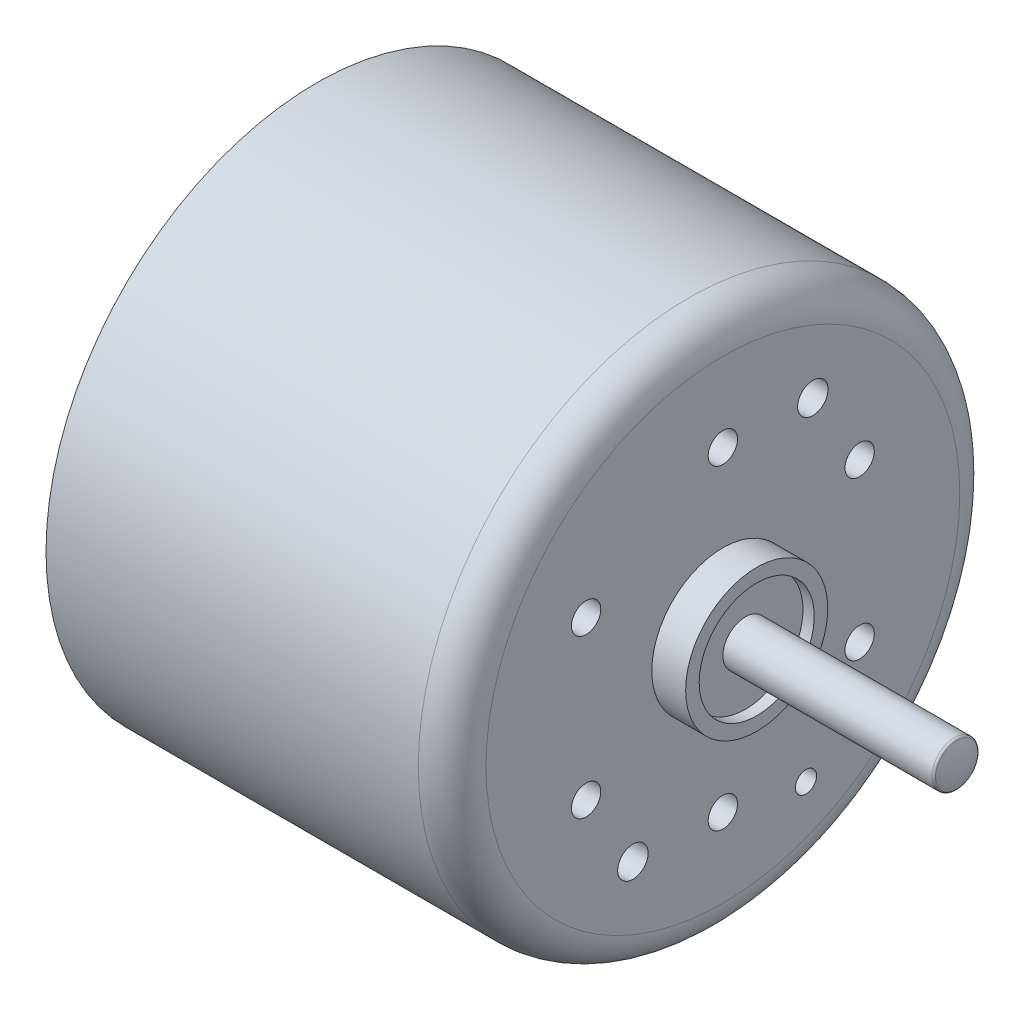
SolidWorks part; units mm, degrees
ref_plane "Plan de face" through (0, 0, 0) normal (0, 0, 1) x (1, 0, 0)
ref_plane "Plan de dessus" through (0, 0, 0) normal (0, 1, 0) x (1, 0, 0)
ref_plane "Plan de droite" through (0, 0, 0) normal (1, 0, 0) x (0, 0, -1)
sketch "Esquisse1" plane through (0, 0, 0) normal (0, 0, 1) x (1, 0, 0)
  line L0 (0, 0) -> (72.656, 0) construction
  line L1 (0, 0) -> (0, 0.8734)
  line L2 (1.0359, 3.2) -> (2.5, 3.2)
  line L3 (2.5, 3.2) -> (2.5, 11.4)
  line L4 (2.5, 11.4) -> (2, 11.4)
  line L5 (2, 11.4) -> (2, 12)
  line L6 (2, 12) -> (18.5, 12)
  line L7 (20, 10.5) -> (20, 3.15)
  line L8 (20, 3.15) -> (21.5, 3.15)
  line L9 (21.5, 3.15) -> (21.5, 2.55)
  line L10 (21.5, 2.55) -> (21, 2.55)
  line L11 (21, 2.55) -> (21, 1)
  line L12 (21, 1) -> (30.2684, 1)
  line L14 (0, 0) -> (30.5, 0)
  arc A0 (20, 10.5) -> (18.5, 12) centre (18.5, 10.5) ccw
  arc A1 (0.5923, 2.9308) -> (0, 0) centre (5.386, 0.4367) ccw
  arc A2 (0.5923, 2.9308) -> (1.0359, 3.2) centre (1.0359, 2.7) cw
  arc A3 (30.5, 0) -> (30.3624, 0.9343) centre (28.1739, 0.1347) ccw
  arc A4 (30.3624, 0.9343) -> (30.2684, 1) centre (30.2684, 0.9) ccw
  point P18 (20, 12)
  dimension "D13" = 1.5
  dimension "D2" = 0.5
  dimension "D5" = 0.1
  dimension "D3" = 0.6
  dimension "D4" = 0.5
  dimension "D6" = 18
  dimension "D8" = 0.6
  dimension "D10" = 0.5
  dimension "D11" = 1.5
  dimension "D12" = 10.5
revolve "Révolution7" add sketch "Esquisse1" angle 360 about L0
sketch "Esquisse2" plane through (20, 0, 0) normal (1, 0, 0) x (0, 0, -1)
  line L0 (0, 7) -> (6.0622, 3.5) construction
  line L1 (3.0311, 5.25) -> (0, 0) construction
  line L2 (3.0311, 5.25) -> (7.7628, 13.4455) construction
  line L3 (0, 0) -> (4.6522, -2.6859) construction
  circle A0 centre (0, 0) radius 7 construction
  circle A1 centre (0, 7) radius 0.65
  circle A2 centre (6.0622, 3.5) radius 0.65
  circle A3 centre (6.0622, -3.5) radius 0.65
  circle A4 centre (0, -7) radius 0.65
  circle A5 centre (-6.0622, -3.5) radius 0.65
  circle A6 centre (-6.0622, 3.5) radius 0.65
  circle A7 centre (3.9875, 6.9066) radius 0.675
  circle A8 centre (-3.9875, -6.9066) radius 0.675
  circle A9 centre (3.6832, -7.6749) radius 0.4717
  dimension "D1" = 1.35
  dimension "D2" = 8.65
extrude "Enlèv. mat.-Extru.1" cut sketch "Esquisse2" against normal blind 3
